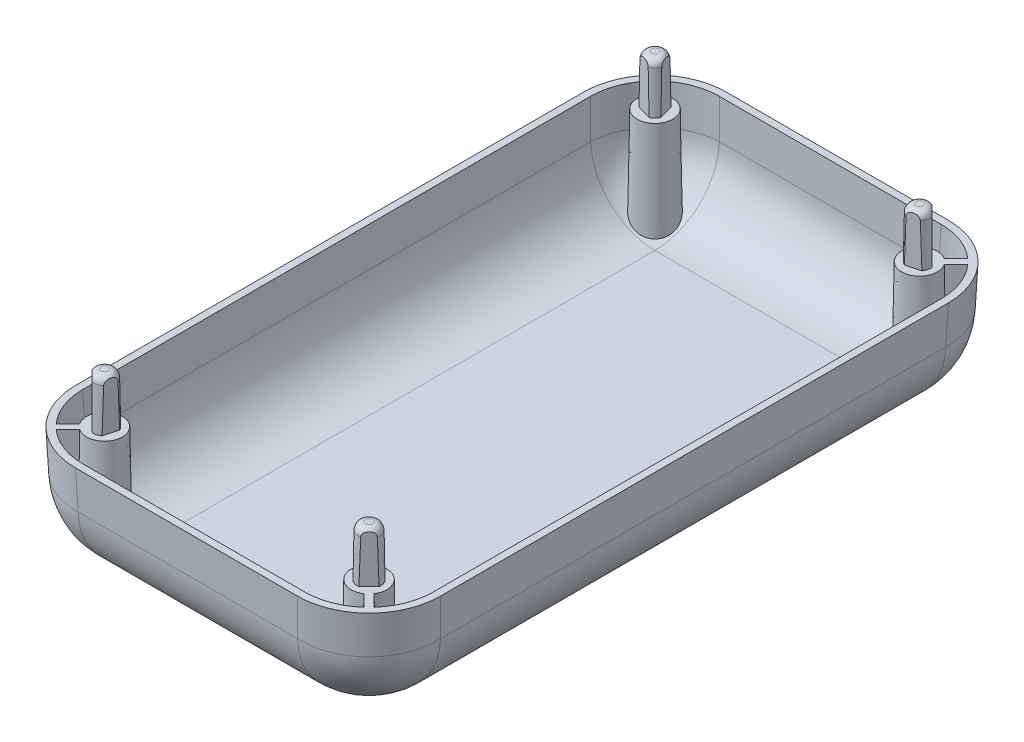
SolidWorks part; units mm, degrees
ref_plane "Vorne" through (0, 0, 0) normal (0, 0, 1) x (1, 0, 0)
ref_plane "Oben" through (0, 0, 0) normal (0, 1, 0) x (1, 0, 0)
ref_plane "Rechts" through (0, 0, 0) normal (1, 0, 0) x (0, 0, -1)
sketch "Skizze1" plane through (0, 0, 0) normal (0, 1, 0) x (1, 0, 0)
  line L1 (-25, 45) -> (25, 45)
  line L2 (-25, 45) -> (-25, -45)
  line L3 (-25, -45) -> (25, -45)
  line L4 (25, 45) -> (25, -45)
  line L5 (-25, 45) -> (25, -45) construction
  line L6 (-25, -45) -> (25, 45) construction
  point P0 (0, 0)
  dimension "D1" = 50
  dimension "D2" = 90
extrude "Linear austragen1" add sketch "Skizze1" along normal blind 15 draft 2
fillet "Verrundung2" radius 10 8 edges at (0, 0, -45) (-25, 0, 0) (0, 0, 45) (25, 0, 0) (-25.2619, 7.5, 45.2619) (-25.2619, 7.5, -45.2619) (25.2619, 7.5, -45.2619) (25.2619, 7.5, 45.2619)
shell "Wandung9" thickness 1
sketch "Skizze4" plane through (0, 15, 0) normal (0, 1, 0) x (1, 0, 0)
  line L4 (-18.5, 38.5) -> (-21.8894, 41.8894) construction
  line L5 (-19.8785, 40.5856) -> (-21.5359, 42.243)
  line L6 (-20.5856, 39.8785) -> (-22.243, 41.5359)
  line L7 (-18.1464, 38.8536) -> (-21.5359, 42.243) construction
  line L8 (-18.5, 38.5) -> (-18.5, -38.5)
  line L9 (18.5, 38.5) -> (-18.5, 38.5)
  line L10 (18.5, -38.5) -> (18.5, 38.5)
  line L11 (-18.5, -38.5) -> (18.5, -38.5)
  line L12 (-18.5, 38.5) -> (-18.5, -38.5) construction
  line L13 (18.5, 38.5) -> (-18.5, 38.5) construction
  line L14 (18.5, -38.5) -> (18.5, 38.5) construction
  line L15 (-18.5, -38.5) -> (18.5, -38.5) construction
  line L16 (-18.8536, 38.1464) -> (-22.243, 41.5359) construction
  line L17 (0, 0) -> (0, 38.5) construction
  line L18 (0, 0) -> (-18.5, 0) construction
  line L19 (18.5, 38.5) -> (21.8894, 41.8894) construction
  line L20 (20.5856, 39.8785) -> (22.243, 41.5359)
  line L21 (19.8785, 40.5856) -> (21.5359, 42.243)
  line L22 (18.5, -38.5) -> (21.8894, -41.8894) construction
  line L23 (-18.5, -38.5) -> (-21.8894, -41.8894) construction
  line L24 (19.8785, -40.5856) -> (21.5359, -42.243)
  line L25 (20.5856, -39.8785) -> (22.243, -41.5359)
  line L26 (-20.5856, -39.8785) -> (-22.243, -41.5359)
  line L27 (-19.8785, -40.5856) -> (-21.5359, -42.243)
  arc A0 (-20.5856, 39.8785) -> (-19.8785, 40.5856) centre (-18.5, 38.5) ccw
  arc A4 (-21.5359, 42.243) -> (-22.243, 41.5359) centre (-21.8894, 41.8894) ccw
  arc A7 (21.5359, 42.243) -> (22.243, 41.5359) centre (21.8894, 41.8894) cw
  arc A8 (20.5856, 39.8785) -> (19.8785, 40.5856) centre (18.5, 38.5) cw
  arc A9 (20.5856, -39.8785) -> (19.8785, -40.5856) centre (18.5, -38.5) ccw
  arc A10 (21.5359, -42.243) -> (22.243, -41.5359) centre (21.8894, -41.8894) ccw
  arc A13 (-21.5359, -42.243) -> (-22.243, -41.5359) centre (-21.8894, -41.8894) cw
  arc A14 (-20.5856, -39.8785) -> (-19.8785, -40.5856) centre (-18.5, -38.5) cw
  ellipse E2 centre (-15.5177, 35.5177) end of major axis (-21.8894, 41.8894) minor radius 9 (-15.5287, 44.5232) -> (-24.5232, 35.5287) ccw construction
  dimension "D4" = 5
  dimension "D1" = 6.5
  dimension "D2" = 0.5
  dimension "D3" = 0.5
extrude "Linear austragen2" add sketch "Skizze4" against normal up to body draft 1
sketch "Skizze5" plane through (0, 15, 0) normal (0, 1, 0) x (1, 0, 0)
  line L0 (-15.427, 0) -> (0, 0) construction
  line L1 (0, 0) -> (0, 30.5371) construction
  circle A0 centre (-18.5, 38.5) radius 1.6
  circle A1 centre (18.5, 38.5) radius 1.6
  circle A2 centre (18.5, -38.5) radius 1.6
  circle A3 centre (-18.5, -38.5) radius 1.6
  dimension "D1" = 3.2
extrude "Linear austragen3" add sketch "Skizze5" along normal blind 7 draft 1
fillet "Verrundung3" radius 1 4 edges at (18.5, 22, 39.9778) (-18.5, 22, 37.0222) (18.5, 22, -39.9778) (-18.5, 22, -37.0222)
sketch "Skizze6" plane through (0, 15, 0) normal (0, 1, 0) x (1, 0, 0)
  line L0 (-19.8785, 40.5856) -> (-21.526, 42.2331) construction
  line L1 (-16.7322, 36.7322) -> (-17.853, 40.9148)
  line L2 (-17.853, 40.9148) -> (-20.9148, 37.853)
  line L3 (-20.9148, 37.853) -> (-16.7322, 36.7322)
  line L4 (0, 0) -> (0, 23.5748) construction
  line L5 (0, 0) -> (-11.8674, 0) construction
  line L6 (20.9148, 37.853) -> (16.7322, 36.7322)
  line L7 (17.853, 40.9148) -> (20.9148, 37.853)
  line L8 (16.7322, 36.7322) -> (17.853, 40.9148)
  line L9 (16.7322, -36.7322) -> (17.853, -40.9148)
  line L10 (17.853, -40.9148) -> (20.9148, -37.853)
  line L11 (20.9148, -37.853) -> (16.7322, -36.7322)
  line L12 (-20.9148, -37.853) -> (-16.7322, -36.7322)
  line L13 (-17.853, -40.9148) -> (-20.9148, -37.853)
  line L14 (-16.7322, -36.7322) -> (-17.853, -40.9148)
  circle A0 centre (-18.5, 38.5) radius 1.25 construction
  circle A1 centre (18.5, 38.5) radius 1.25 construction
  circle A2 centre (18.5, -38.5) radius 1.25 construction
  circle A3 centre (-18.5, -38.5) radius 1.25 construction
  dimension "D1" = 2.5
extrude "Linear austragen4" cut sketch "Skizze6" along normal through all flip side to cut
